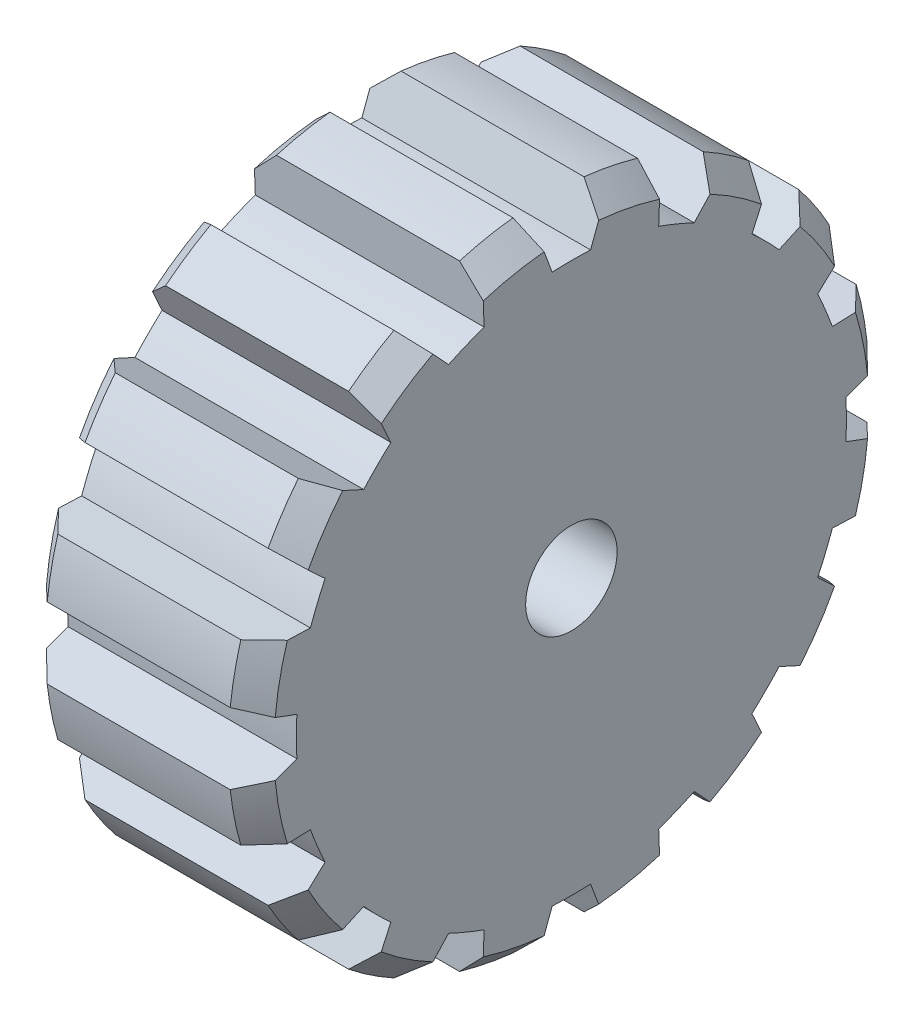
SolidWorks part; units mm, degrees
ref_plane "Front" through (0, 0, 0) normal (0, 0, 1) x (1, 0, 0)
ref_plane "Top" through (0, 0, 0) normal (0, 1, 0) x (1, 0, 0)
ref_plane "Right" through (0, 0, 0) normal (1, 0, 0) x (0, 0, -1)
sketch "Sketch1" plane through (0, 0, 0) normal (0, 0, 1) x (1, 0, 0)
  line L0 (0, 0) -> (-6, 0)
  line L1 (-6, 1) -> (-6, 4)
  line L2 (-6, 4) -> (-5, 4)
  line L3 (-5, 4) -> (-5, 7)
  line L4 (-5, 7) -> (0, 7)
  line L5 (0, 7) -> (0, 1)
  line L6 (0, 1) -> (-6, 1)
  dimension "D1" = 7
  dimension "D2" = 4
  dimension "D3" = 6
  dimension "D4" = 1
  dimension "D5" = 1
revolve "Revolve1" add sketch "Sketch1" angle 360 about L0
sketch "Sketch3" plane through (0, 0, 0) normal (1, 0, 0) x (0, 0, -1)
  line L0 (-0.785, 6.9789) -> (-0.42, 6)
  line L1 (0.785, 6.9789) -> (0.785, 7.7892)
  line L2 (2.6841, 5.3826) -> (3.396, 6.1473)
  line L3 (-0.785, 7.7892) -> (-0.785, 6.9789)
  line L4 (3.396, 6.1473) -> (3.7061, 6.8959)
  line L5 (0.42, 6) -> (0.785, 6.9789)
  line L6 (2.2556, 7.4967) -> (1.9455, 6.7481)
  line L7 (1.9455, 6.7481) -> (1.9081, 5.704)
  line L8 (4.5396, 3.9457) -> (5.4899, 4.3798)
  line L9 (5.4899, 4.3798) -> (6.0629, 4.9527)
  line L10 (4.9527, 6.0629) -> (4.3798, 5.4899)
  line L11 (4.3798, 5.4899) -> (3.9457, 4.5396)
  line L12 (5.704, 1.9081) -> (6.7481, 1.9455)
  line L13 (6.7481, 1.9455) -> (7.4967, 2.2556)
  line L14 (6.8959, 3.7061) -> (6.1473, 3.396)
  line L15 (6.1473, 3.396) -> (5.3826, 2.6841)
  line L16 (6, -0.42) -> (6.9789, -0.785)
  line L17 (6.9789, -0.785) -> (7.7892, -0.785)
  line L18 (7.7892, 0.785) -> (6.9789, 0.785)
  line L19 (6.9789, 0.785) -> (6, 0.42)
  line L20 (5.3826, -2.6841) -> (6.1473, -3.396)
  line L21 (6.1473, -3.396) -> (6.8959, -3.7061)
  line L22 (7.4967, -2.2556) -> (6.7481, -1.9455)
  line L23 (6.7481, -1.9455) -> (5.704, -1.9081)
  line L24 (3.9457, -4.5396) -> (4.3798, -5.4899)
  line L25 (4.3798, -5.4899) -> (4.9527, -6.0629)
  line L26 (6.0629, -4.9527) -> (5.4899, -4.3798)
  line L27 (5.4899, -4.3798) -> (4.5396, -3.9457)
  line L28 (1.9081, -5.704) -> (1.9455, -6.7481)
  line L29 (1.9455, -6.7481) -> (2.2556, -7.4967)
  line L30 (3.7061, -6.8959) -> (3.396, -6.1473)
  line L31 (3.396, -6.1473) -> (2.6841, -5.3826)
  line L32 (-0.42, -6) -> (-0.785, -6.9789)
  line L33 (-0.785, -6.9789) -> (-0.785, -7.7892)
  line L34 (0.785, -7.7892) -> (0.785, -6.9789)
  line L35 (0.785, -6.9789) -> (0.42, -6)
  line L36 (-2.6841, -5.3826) -> (-3.396, -6.1473)
  line L37 (-3.396, -6.1473) -> (-3.7061, -6.8959)
  line L38 (-2.2556, -7.4967) -> (-1.9455, -6.7481)
  line L39 (-1.9455, -6.7481) -> (-1.9081, -5.704)
  line L40 (-4.5396, -3.9457) -> (-5.4899, -4.3798)
  line L41 (-5.4899, -4.3798) -> (-6.0629, -4.9527)
  line L42 (-4.9527, -6.0629) -> (-4.3798, -5.4899)
  line L43 (-4.3798, -5.4899) -> (-3.9457, -4.5396)
  line L44 (-5.704, -1.9081) -> (-6.7481, -1.9455)
  line L45 (-6.7481, -1.9455) -> (-7.4967, -2.2556)
  line L46 (-6.8959, -3.7061) -> (-6.1473, -3.396)
  line L47 (-6.1473, -3.396) -> (-5.3826, -2.6841)
  line L48 (-6, 0.42) -> (-6.9789, 0.785)
  line L49 (-6.9789, 0.785) -> (-7.7892, 0.785)
  line L50 (-7.7892, -0.785) -> (-6.9789, -0.785)
  line L51 (-6.9789, -0.785) -> (-6, -0.42)
  line L52 (-5.3826, 2.6841) -> (-6.1473, 3.396)
  line L53 (-6.1473, 3.396) -> (-6.8959, 3.7061)
  line L54 (-7.4967, 2.2556) -> (-6.7481, 1.9455)
  line L55 (-6.7481, 1.9455) -> (-5.704, 1.9081)
  line L56 (-3.9457, 4.5396) -> (-4.3798, 5.4899)
  line L57 (-4.3798, 5.4899) -> (-4.9527, 6.0629)
  line L58 (-6.0629, 4.9527) -> (-5.4899, 4.3798)
  line L59 (-5.4899, 4.3798) -> (-4.5396, 3.9457)
  line L60 (-1.9081, 5.704) -> (-1.9455, 6.7481)
  line L61 (-1.9455, 6.7481) -> (-2.2556, 7.4967)
  line L62 (-3.7061, 6.8959) -> (-3.396, 6.1473)
  line L63 (-3.396, 6.1473) -> (-2.6841, 5.3826)
  circle A0 centre (0, 0) radius 7 construction
  arc A1 (0.42, 6) -> (-0.42, 6) centre (0, -2.9902) ccw
  arc A2 (0.785, 7.7892) -> (-0.785, 7.7892) centre (0, -2.9902) ccw
  arc A3 (2.6841, 5.3826) -> (1.9081, 5.704) centre (-1.1443, -2.7626) ccw
  arc A4 (3.7061, 6.8959) -> (2.2556, 7.4967) centre (-1.1443, -2.7626) ccw
  arc A5 (4.5396, 3.9457) -> (3.9457, 4.5396) centre (-2.1144, -2.1144) ccw
  arc A6 (6.0629, 4.9527) -> (4.9527, 6.0629) centre (-2.1144, -2.1144) ccw
  arc A7 (5.704, 1.9081) -> (5.3826, 2.6841) centre (-2.7626, -1.1443) ccw
  arc A8 (7.4967, 2.2556) -> (6.8959, 3.7061) centre (-2.7626, -1.1443) ccw
  arc A9 (6, -0.42) -> (6, 0.42) centre (-2.9902, 0) ccw
  arc A10 (7.7892, -0.785) -> (7.7892, 0.785) centre (-2.9902, 0) ccw
  arc A11 (5.3826, -2.6841) -> (5.704, -1.9081) centre (-2.7626, 1.1443) ccw
  arc A12 (6.8959, -3.7061) -> (7.4967, -2.2556) centre (-2.7626, 1.1443) ccw
  arc A13 (3.9457, -4.5396) -> (4.5396, -3.9457) centre (-2.1144, 2.1144) ccw
  arc A14 (4.9527, -6.0629) -> (6.0629, -4.9527) centre (-2.1144, 2.1144) ccw
  arc A15 (1.9081, -5.704) -> (2.6841, -5.3826) centre (-1.1443, 2.7626) ccw
  arc A16 (2.2556, -7.4967) -> (3.7061, -6.8959) centre (-1.1443, 2.7626) ccw
  arc A17 (-0.42, -6) -> (0.42, -6) centre (0, 2.9902) ccw
  arc A18 (-0.785, -7.7892) -> (0.785, -7.7892) centre (0, 2.9902) ccw
  arc A19 (-2.6841, -5.3826) -> (-1.9081, -5.704) centre (1.1443, 2.7626) ccw
  arc A20 (-3.7061, -6.8959) -> (-2.2556, -7.4967) centre (1.1443, 2.7626) ccw
  arc A21 (-4.5396, -3.9457) -> (-3.9457, -4.5396) centre (2.1144, 2.1144) ccw
  arc A22 (-6.0629, -4.9527) -> (-4.9527, -6.0629) centre (2.1144, 2.1144) ccw
  arc A23 (-5.704, -1.9081) -> (-5.3826, -2.6841) centre (2.7626, 1.1443) ccw
  arc A24 (-7.4967, -2.2556) -> (-6.8959, -3.7061) centre (2.7626, 1.1443) ccw
  arc A25 (-6, 0.42) -> (-6, -0.42) centre (2.9902, 0) ccw
  arc A26 (-7.7892, 0.785) -> (-7.7892, -0.785) centre (2.9902, 0) ccw
  arc A27 (-5.3826, 2.6841) -> (-5.704, 1.9081) centre (2.7626, -1.1443) ccw
  arc A28 (-6.8959, 3.7061) -> (-7.4967, 2.2556) centre (2.7626, -1.1443) ccw
  arc A29 (-3.9457, 4.5396) -> (-4.5396, 3.9457) centre (2.1144, -2.1144) ccw
  arc A30 (-4.9527, 6.0629) -> (-6.0629, 4.9527) centre (2.1144, -2.1144) ccw
  arc A31 (-1.9081, 5.704) -> (-2.6841, 5.3826) centre (1.1443, -2.7626) ccw
  arc A32 (-2.2556, 7.4967) -> (-3.7061, 6.8959) centre (1.1443, -2.7626) ccw
  dimension "D3" = 6
chamfer "Chamfer4" distance 0.5 angle 45 3 edges at (0, 7, 0) (-5, 7, 0) (-6, 4, 0)
extrude "Cut-Extrude1" cut sketch "Sketch3" against normal blind 10
